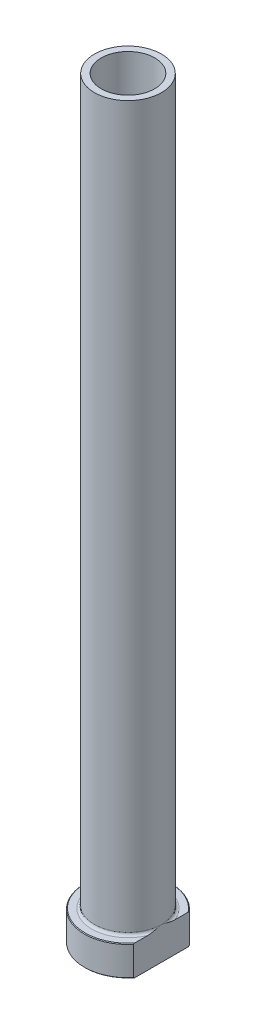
SolidWorks part; units mm, degrees
ref_plane "Front Plane" through (0, 0, 0) normal (0, 0, 1) x (1, 0, 0)
ref_plane "Top Plane" through (0, 0, 0) normal (0, 1, 0) x (1, 0, 0)
ref_plane "Right Plane" through (0, 0, 0) normal (1, 0, 0) x (0, 0, -1)
sketch "Sketch1" plane through (0, 0, 0) normal (0, 0, 1) x (1, 0, 0)
  line L0 (-8, 225) -> (-10, 225)
  line L1 (-10, 225) -> (-10, 9)
  line L2 (-10, 9) -> (-13, 9)
  line L3 (-13, 9) -> (-13, 0)
  line L4 (12.65, 0) -> (-12.65, 0) construction
  line L5 (-13, 0) -> (-8.25, 0)
  line L6 (-8, 170) -> (-8, 225)
  line L7 (0, 92.1877) -> (0, -15.5353) construction
  line L8 (0, -14.3) -> (0, 14.3) construction
  line L9 (-8, 170) -> (-8.25, 158)
  line L10 (-8.25, 158) -> (-8.25, 0)
  dimension "D1" = 0.25
  dimension "ID" = 16
  dimension "OD" = 20
  dimension "L" = 225
  dimension "H" = 26
  dimension "T" = 9
  dimension "N" = 55
  dimension "D2" = 12
  dimension "L-N" = 170
revolve "Revolve1" add sketch "Sketch1" angle 360 about L7
fillet "Fillet1" radius 0.8 1 edges at (0, 9, 10)
chamfer "Chamfer1" distance 0.2 angle 45 2 edges at (0, 9, 13) (0, 0, 13)
sketch "Sketch2" plane through (0, 0, 0) normal (0, -1, 0) x (1, 0, 0)
  line L0 (10, 8.3066) -> (10, -8.3066)
  circle A0 centre (0, 0) radius 13 construction
  arc A1 (10, 8.3066) -> (10, -8.3066) centre (0, 0) cw
  circle A2 centre (0, 0) radius 10 construction
extrude "Cut-Extrude1" cut sketch "Sketch2" against normal through all
chamfer "Chamfer2" distance 0.5 angle 45 1 edges at (0, 0, 8.25)
